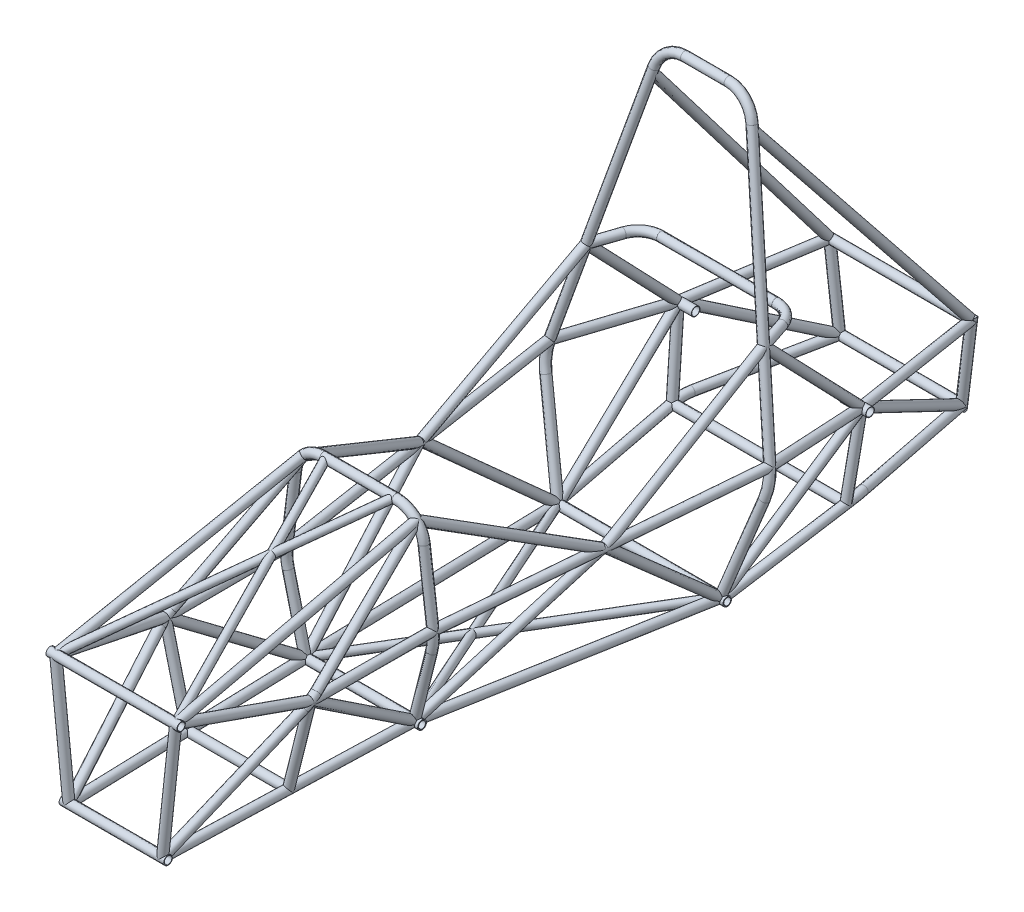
SolidWorks part; units mm, degrees
ref_plane "Front Plane" through (0, 0, 0) normal (0, 0, 1) x (1, 0, 0)
ref_plane "Top Plane" through (0, 0, 0) normal (0, 1, 0) x (1, 0, 0)
ref_plane "Right Plane" through (0, 0, 0) normal (1, 0, 0) x (0, 0, -1)
sketch "Sketch1-sidelayout" plane through (0, 0, 0) normal (1, 0, 0) x (0, 0, -1)
  line L0 (-9.8366, 0) -> (711.2, 0) construction
  line L1 (711.2, 0) -> (1524, -57.15) construction
  line L2 (2286, 19.05) -> (2286, 247.65) construction
  line L3 (1524, -57.15) -> (1905, 19.05) construction
  line L4 (1905, 19.05) -> (2286, 19.05) construction
  line L5 (0, 0) -> (0, 355.6) construction
  line L6 (711.2, 0) -> (711.2, 533.4) construction
  line L7 (1524, -57.15) -> (1721.063, 1060.45) construction
  line L8 (711.2, 533.4) -> (1721.063, 1060.45) construction
  line L9 (1499.739, 381.1358) -> (1499.739, 661.1358) construction
  line L10 (1106.8366, 88.3429) -> (1499.739, 381.1358) construction
  line L11 (711.2, 533.4) -> (0, 355.6) construction
  line L12 (1524, -57.15) -> (1320.235, -57.15) construction
  line L13 (1106.8366, 88.3429) -> (711.4197, 261.8271) construction
  line L14 (2286, 247.65) -> (1707.831, 985.4076) construction
  line L15 (711.4197, 261.8271) -> (233.2798, 25.4) construction
  line L16 (233.2798, 25.4) -> (67.8276, 250.5442) construction
  line L17 (1367.8738, 818.8173) -> (1439.1642, 856.0239) construction
  line L18 (1036.8918, -6.986) -> (1174.6305, -16.6708) construction
  line L19 (2286, 247.65) -> (1905, 247.65) construction
  line L20 (1905, 19.05) -> (1905, 247.65) construction
  line L21 (1905, 247.65) -> (1584.4625, 285.75) construction
  line L22 (355.6, 444.5) -> (355.6, 0) construction
  line L23 (0, 0) -> (711.2, 508) construction
  line L24 (2410.1225, -107.95) -> (-155.516, -107.95) construction
  circle A0 centre (1499.739, 661.1358) radius 150 construction
  circle A1 centre (1499.739, 381.1358) radius 100 construction
  circle A2 centre (1106.8366, 88.3429) radius 100 construction
  circle A3 centre (1499.739, 661.1358) radius 200.8 construction
  point P27 (1577.7445, 247.65)
  point P30 (711.2, 228.6)
  point P31 (711.2, 508)
  point P34 (355.6, 254)
  point P35 (711.2, 254)
  point P39 (-155.516, -107.95)
  point P40 (2410.1225, -107.95)
  dimension "D7" = 300
  dimension "D8" = 200
  dimension "D11" = 200
  dimension "D12" = 50.8
  dimension "D1" = 711.2
  dimension "D2" = 533.4
  dimension "D3" = 355.6
  dimension "D4" = 1524
  dimension "D5" = 57.15
  dimension "D6" = 76.2
  dimension "D9" = 280
  dimension "D10" = 490
  dimension "D13" = 1905
  dimension "D14" = 2286
  dimension "D15" = 228.6
  dimension "D16" = 1117.6
  dimension "D17" = 100
  dimension "D18" = 431.8
  dimension "D19" = 533.4
  dimension "D20" = 279.4
  dimension "D21" = 76.2
  dimension "D22" = 50.8
  dimension "D23" = 15.875
  dimension "D24" = 130
  dimension "D25" = 25.4
  dimension "D26" = 100
  dimension "D27" = 342.9
  dimension "D28" = 304.8
  dimension "D29" = 254
  dimension "D30" = 355.6
  dimension "D31" = 228.6
  dimension "D32" = 254
  dimension "D33" = 50.8
sketch3d "3DSketch1-widths"
  line L0 (-152.4, 0, 0) -> (152.4, 0, 0) construction
  line L1 (-190.5, 355.6, 0) -> (190.5, 355.6, 0) construction
  line L2 (177.8, 533.4, -711.2) -> (-177.8, 533.4, -711.2) construction
  line L3 (180.975, 0, -711.2) -> (-180.975, 0, -711.2) construction
  line L4 (257.175, -57.15, -1524) -> (-257.175, -57.15, -1524) construction
  line L5 (330.2, 247.65, -1577.7445) -> (-330.2, 247.65, -1577.7445) construction
  line L6 (215.9, 228.6, -711.2) -> (-215.9, 228.6, -711.2) construction
  line L7 (254, 19.05, -1905) -> (-254, 19.05, -1905) construction
  line L8 (177.8, 19.05, -2286) -> (-177.8, 19.05, -2286) construction
  line L9 (206.375, 247.65, -2286) -> (-206.375, 247.65, -2286) construction
  dimension "D1" = 304.8
  dimension "D2" = 381
  dimension "D3" = 514.35
  dimension "D4" = 361.95
  dimension "D5" = 660.4
  dimension "D6" = 431.8
  dimension "D10" = 355.6
  dimension "D7" = 508
  dimension "D8" = 355.6
  dimension "D9" = 412.75
sketch3d "3DSketch1-main stations"
  line L0 (-136.525, 0, 0) -> (-174.625, 355.6, 0) construction
  line L1 (-152.4, 0, 0) -> (152.4, 0, 0) construction
  line L2 (-190.5, 355.6, 0) -> (190.5, 355.6, 0) construction
  line L3 (136.525, 0, 0) -> (174.625, 355.6, 0) construction
  line L4 (-212.4397, 256.2828, -711.2) -> (-186.7777, 461.5786, -711.2) construction
  line L5 (-236.5248, -57.15, -1524) -> (-318.357, 209.1154, -1570.9498) construction
  line L6 (236.5248, -57.15, -1524) -> (318.357, 209.1154, -1570.9498) construction
  line L7 (-105.4196, 533.4, -711.2) -> (105.4196, 533.4, -711.2) construction
  line L8 (186.7777, 461.5786, -711.2) -> (212.4397, 256.2828, -711.2) construction
  line L9 (-158.75, 0, -711.2) -> (-209.1337, 201.5348, -711.2) construction
  line L10 (180.975, 0, -711.2) -> (-180.975, 0, -711.2) construction
  line L11 (209.1337, 201.5348, -711.2) -> (158.75, 0, -711.2) construction
  line L12 (63.5, 1060.45, -1721.063) -> (-63.5, 1060.45, -1721.063) construction
  line L13 (320.4636, 286.7525, -1584.6393) -> (143.132, 998.9347, -1710.2162) construction
  line L14 (-143.132, 998.9347, -1710.2162) -> (-320.4636, 286.7525, -1584.6393) construction
  line L15 (257.175, -57.15, -1524) -> (-257.175, -57.15, -1524) construction
  line L16 (320.7132, 285.75, -1584.4625) -> (-320.7132, 285.75, -1584.4625) construction
  line L17 (206.375, 247.65, -2286) -> (177.8, 19.05, -2286) construction
  line L18 (-177.8, 19.05, -2286) -> (-206.375, 247.65, -2286) construction
  line L20 (146.5002, 985.4076, -1707.831) -> (-146.5002, 985.4076, -1707.831) construction
  line L21 (164.7492, 508, -711.2) -> (-164.7492, 508, -711.2) construction
  line L22 (212.725, 254, -711.2) -> (-212.725, 254, -711.2) construction
  arc A0 (105.4196, 533.4, -711.2) -> (186.7777, 461.5786, -711.2) centre (105.4196, 451.4088, -711.2) ccw construction
  arc A1 (-186.7777, 461.5786, -711.2) -> (-105.4196, 533.4, -711.2) centre (-105.4196, 451.4088, -711.2) ccw construction
  arc A2 (-212.4397, 256.2828, -711.2) -> (-209.1337, 201.5348, -711.2) centre (-64.241, 237.7579, -711.2) ccw construction
  arc A3 (212.4397, 256.2828, -711.2) -> (209.1337, 201.5348, -711.2) centre (64.241, 237.7579, -711.2) ccw construction
  arc A4 (63.5, 1060.45, -1721.063) -> (143.132, 998.9347, -1710.2162) centre (63.5, 979.7044, -1706.8254) ccw construction
  arc A5 (-63.5, 1060.45, -1721.063) -> (-143.132, 998.9347, -1710.2162) centre (-63.5, 979.7044, -1706.8254) ccw construction
  arc A6 (318.357, 209.1154, -1570.9498) -> (320.4636, 286.7525, -1584.6393) centre (175.409, 251.7233, -1578.4627) ccw construction
  arc A7 (-318.357, 209.1154, -1570.9498) -> (-320.4636, 286.7525, -1584.6393) centre (-175.409, 251.7233, -1578.4627) ccw construction
  point P26 (177.8, 533.4, -711.2)
  point P27 (105.4196, 451.4088, -793.1912)
  point P30 (-177.8, 533.4, -711.2)
  point P31 (-105.4196, 451.4088, -793.1912)
  point P40 (-215.9, 228.6, -711.2)
  point P41 (-64.241, 237.7579, -561.848)
  point P44 (215.9, 228.6, -711.2)
  point P45 (64.241, 237.7579, -860.552)
  point P59 (127.8148, 1060.45, -1721.063)
  point P60 (63.5, 965.4668, -1787.571)
  point P63 (-127.8148, 1060.45, -1721.063)
  point P64 (-63.5, 993.9421, -1626.0798)
  point P67 (330.2, 247.65, -1577.7445)
  point P68 (175.409, 277.6581, -1431.3797)
  point P71 (-330.2, 247.65, -1577.7445)
  point P72 (-175.409, 225.7886, -1725.5457)
  dimension "D7" = 81.9912
  dimension "D8" = 20.6502
  dimension "D9" = 20.6502
  dimension "D10" = 81.9912
  dimension "D12" = 149.352
  dimension "D13" = 149.352
  dimension "D1" = 15.875
  dimension "D2" = 15.875
  dimension "D3" = 15.875
  dimension "D4" = 15.875
  dimension "D5" = 22.225
  dimension "D6" = 22.225
  dimension "D11" = 127
sketch3d "3DSketch2-sides"
  line L0 (136.525, 0, 0) -> (158.75, 0, -711.2) construction
  line L1 (-152.4, 0, 0) -> (152.4, 0, 0) construction
  line L2 (180.975, 0, -711.2) -> (-180.975, 0, -711.2) construction
  line L3 (-136.525, 0, 0) -> (-158.75, 0, -711.2) construction
  line L4 (158.75, 0, -711.2) -> (236.5248, -57.15, -1524) construction
  line L5 (-236.5248, -57.15, -1524) -> (-158.75, 0, -711.2) construction
  line L6 (241.3, -57.15, -1524) -> (253.2566, 14.5893, -1882.6966) construction
  line L7 (257.175, -57.15, -1524) -> (-257.175, -57.15, -1524) construction
  line L8 (249.5369, 19.05, -1927.3153) -> (177.8, 19.05, -2286) construction
  line L9 (177.8, 19.05, -2286) -> (-177.8, 19.05, -2286) construction
  line L10 (-177.8, 19.05, -2286) -> (-249.5369, 19.05, -1927.3153) construction
  line L11 (-253.2566, 14.5893, -1882.6966) -> (-241.3, -57.15, -1524) construction
  line L12 (292.1, 247.65, -1905) -> (-292.1, 247.65, -1905) construction
  line L13 (320.7132, 285.75, -1584.4625) -> (266.7, 247.65, -1905) construction
  line L14 (-320.7132, 285.75, -1584.4625) -> (-266.7, 247.65, -1905) construction
  line L15 (266.7, 247.65, -1905) -> (206.375, 247.65, -2286) construction
  line L16 (-206.375, 247.65, -2286) -> (-266.7, 247.65, -1905) construction
  line L17 (174.625, 355.6, 0) -> (164.7492, 508, -711.2) construction
  line L18 (-252.9622, 12.8233, -1873.8666) -> (252.9622, 12.8233, -1873.8666) construction
  line L19 (0, 12.8233, -1873.8666) -> (0, 247.65, -1905) construction
  line L20 (0, -57.15, -1524) -> (0, 19.05, -1905) construction
  line L23 (320.7132, 285.75, -1584.4625) -> (212.725, 254, -711.2) construction
  line L24 (-320.7132, 285.75, -1584.4625) -> (-212.725, 254, -711.2) construction
  line L25 (-174.625, 355.6, 0) -> (-164.7492, 508, -711.2) construction
  line L26 (206.375, 247.65, -2286) -> (146.5002, 985.4076, -1707.831) construction
  line L27 (-146.5002, 985.4076, -1707.831) -> (-206.375, 247.65, -2286) construction
  arc A0 (253.2566, 14.5893, -1882.6966) -> (249.5369, 19.05, -1927.3153) centre (139.2726, -79.2428, -1905.2625) ccw construction
  arc A1 (-249.5369, 19.05, -1927.3153) -> (-253.2566, 14.5893, -1882.6966) centre (-139.2726, -79.2428, -1905.2625) ccw construction
  point P28 (254, 19.05, -1905)
  point P29 (42.8886, 33.2052, -1885.9857)
  point P38 (-254, 19.05, -1905)
  point P39 (-42.8886, 33.2052, -1885.9857)
  point P52 (215.9, 247.65, -1905)
  point P54 (-215.9, 247.65, -1905)
  point P62 (0, 12.8233, -1873.8666)
  dimension "D3" = 149.352
  dimension "D6" = 149.352
  dimension "D2" = 15.875
  dimension "D4" = 15.875
  dimension "D5" = 31.75
  dimension "D7" = 76.2
  dimension "D8" = 25.4
  dimension "D9" = 76.2
  dimension "D10" = 25.4
  dimension "D11" = 431.8
sketch3d "3DSketch3-side diag"
  line L0 (212.725, 254, -355.6) -> (-212.725, 254, -355.6) construction
  line L1 (174.625, 355.6, 0) -> (211.2274, 254, -355.6) construction
  line L2 (136.525, 0, 0) -> (209.0836, 241.8621, -338.6069) construction
  line L3 (210.4117, 266.2475, -372.7465) -> (164.7492, 508, -711.2) construction
  line L4 (164.7492, 508, -711.2) -> (266.8518, 269.914, -1148.904) construction
  line L5 (-174.625, 355.6, 0) -> (-211.2274, 254, -355.6) construction
  line L6 (-164.7492, 508, -711.2) -> (-266.8518, 269.914, -1148.904) construction
  line L7 (-158.75, 0, -711.2) -> (-211.2274, 254, -355.6) construction
  line L8 (320.7132, 285.75, -1584.4625) -> (212.725, 254, -711.2) construction
  line L9 (-320.7132, 285.75, -1584.4625) -> (-212.725, 254, -711.2) construction
  line L10 (267.7546, 270.1795, -1156.2054) -> (258.4287, 535.8912, -1628.5692) construction
  line L11 (320.4636, 286.7525, -1584.6393) -> (143.132, 998.9347, -1710.2162) construction
  line L12 (-267.7546, 270.1795, -1156.2054) -> (-258.4287, 535.8912, -1628.5692) construction
  line L13 (-143.132, 998.9347, -1710.2162) -> (-320.4636, 286.7525, -1584.6393) construction
  line L14 (-258.4287, 535.8912, -1628.5692) -> (258.4287, 535.8912, -1628.5692) construction
  line L15 (0, -57.15, -1524) -> (0, 1060.45, -1721.063) construction
  line L16 (258.4287, 535.8912, -1628.5692) -> (266.7, 247.65, -1905) construction
  line L17 (-266.7, 247.65, -1905) -> (-258.4287, 535.8912, -1628.5692) construction
  line L18 (158.75, 0, -711.2) -> (266.8518, 269.914, -1148.904) construction
  line L19 (-158.75, 0, -711.2) -> (-266.8518, 269.914, -1148.904) construction
  line L20 (-267.7546, 270.1795, -1156.2054) -> (-236.5248, -57.15, -1524) construction
  line L21 (267.7546, 270.1795, -1156.2054) -> (236.5248, -57.15, -1524) construction
  line L22 (236.5248, -57.15, -1524) -> (266.7, 247.65, -1905) construction
  line L23 (266.7, 247.65, -1905) -> (177.8, 19.05, -2286) construction
  line L24 (-177.8, 19.05, -2286) -> (-266.7, 247.65, -1905) construction
  line L25 (-266.7, 247.65, -1905) -> (-236.5248, -57.15, -1524) construction
  line L26 (-136.525, 0, 0) -> (-209.0836, 241.8621, -338.6069) construction
  line L27 (-210.4117, 266.2475, -372.7465) -> (-164.7492, 508, -711.2) construction
  line L28 (158.75, 0, -711.2) -> (211.2274, 254, -355.6) construction
  line L29 (147.6375, 0, -355.6) -> (-147.6375, 0, -355.6) construction
  line L30 (136.525, 0, 0) -> (158.75, 0, -711.2) construction
  line L31 (147.6375, 0, -355.6) -> (211.2274, 254, -355.6) construction
  line L32 (-147.6375, 0, -355.6) -> (-211.2274, 254, -355.6) construction
  line L33 (-136.525, 0, 0) -> (-158.75, 0, -711.2) construction
  line L34 (212.725, 254, -711.2) -> (211.2274, 254, -355.6) construction
  line L35 (-211.2274, 254, -355.6) -> (-212.725, 254, -711.2) construction
  line L36 (-152.4, 0, 0) -> (152.4, 0, 0) construction
  line L37 (252.9622, 12.8233, -1873.8666) -> (266.7, 247.65, -1905) construction
  line L38 (-266.7, 247.65, -1905) -> (-252.9622, 12.8233, -1873.8666) construction
  line L39 (0, 535.8912, -1628.5692) -> (0, 535.8912, -1755.5692) construction
  line L40 (215.9, 535.8912, -1755.5692) -> (-215.9, 535.8912, -1755.5692) construction
  line L41 (215.9, 535.8912, -1755.5692) -> (258.4287, 535.8912, -1628.5692) construction
  line L42 (-215.9, 535.8912, -1755.5692) -> (-258.4287, 535.8912, -1628.5692) construction
  arc A0 (210.4117, 266.2475, -372.7465) -> (209.0836, 241.8621, -338.6069) centre (61.9517, 256.7741, -359.4837) ccw construction
  arc A1 (-210.4117, 266.2475, -372.7465) -> (-209.0836, 241.8621, -338.6069) centre (-61.9517, 256.7741, -359.4837) ccw construction
  point P5 (212.725, 254, -355.6)
  point P8 (61.9517, 135.2414, -446.2928)
  point P11 (-212.725, 254, -355.6)
  point P30 (0, 535.8912, -1628.5692)
  point P55 (-61.9517, 378.3068, -272.6746)
  dimension "D7" = 149.352
  dimension "D8" = 149.352
  dimension "D1" = 441.325
  dimension "D6" = 425.45
  dimension "D2" = 441.325
  dimension "D3" = 254
  dimension "D4" = 431.8
  dimension "D5" = 431.8
  dimension "D9" = 127
  dimension "D10" = 431.8
sketch3d "3DSketch4-cross sup"
  line L0 (158.75, 0, -711.2) -> (-236.5248, -57.15, -1524) construction
  line L1 (236.5248, -57.15, -1524) -> (-158.75, 0, -711.2) construction
  line L2 (0, 0, -711.2) -> (0, -57.15, -1524) construction
  line L7 (174.625, 355.6, 0) -> (-99.0696, 533.4, -711.2) construction
  line L8 (99.0696, 533.4, -711.2) -> (-174.625, 355.6, 0) construction
  line L9 (177.8, 533.4, -711.2) -> (-177.8, 533.4, -711.2) construction
  point P8 (0, -22.9525, -1037.6362)
  point P32 (0, 469.0415, -453.7659)
  dimension "D3" = 6.35
sketch3d "3DSketch5"
  line L0 (-152.4, 0, 0) -> (152.4, 0, 0)
  line L1 (-152.4, 0, 0) -> (152.4, 0, 0) construction
  line L2 (-190.5, 355.6, 0) -> (190.5, 355.6, 0)
  line L3 (-190.5, 355.6, 0) -> (190.5, 355.6, 0) construction
  line L4 (136.525, 0, 0) -> (174.625, 355.6, 0)
  line L5 (136.525, 0, 0) -> (174.625, 355.6, 0) construction
  line L6 (-136.525, 0, 0) -> (-174.625, 355.6, 0)
  line L7 (-136.525, 0, 0) -> (-174.625, 355.6, 0) construction
  line L8 (-136.525, 0, 0) -> (-158.75, 0, -711.2) construction
  line L9 (-180.975, 0, -711.2) -> (180.975, 0, -711.2)
  line L10 (180.975, 0, -711.2) -> (-180.975, 0, -711.2) construction
  line L11 (-158.75, 0, -711.2) -> (-209.1337, 201.5348, -711.2)
  line L12 (-158.75, 0, -711.2) -> (-209.1337, 201.5348, -711.2) construction
  line L13 (-212.4397, 256.2828, -711.2) -> (-186.7777, 461.5786, -711.2)
  line L14 (-105.4196, 533.4, -711.2) -> (105.4196, 533.4, -711.2)
  line L15 (186.7777, 461.5786, -711.2) -> (212.4397, 256.2828, -711.2)
  line L16 (177.8, 533.4, -711.2) -> (-177.8, 533.4, -711.2) construction
  line L17 (-212.4397, 256.2828, -711.2) -> (-186.7777, 461.5786, -711.2) construction
  line L18 (186.7777, 461.5786, -711.2) -> (212.4397, 256.2828, -711.2) construction
  line L19 (209.1337, 201.5348, -711.2) -> (158.75, 0, -711.2)
  line L20 (209.1337, 201.5348, -711.2) -> (158.75, 0, -711.2) construction
  line L21 (-236.5248, -57.15, -1524) -> (-318.357, 209.1154, -1570.9498)
  line L22 (-320.4636, 286.7525, -1584.6393) -> (-143.132, 998.9347, -1710.2162)
  line L23 (-63.5, 1060.45, -1721.063) -> (63.5, 1060.45, -1721.063)
  line L24 (143.132, 998.9347, -1710.2162) -> (320.4636, 286.7525, -1584.6393)
  line L25 (318.357, 209.1154, -1570.9498) -> (236.5248, -57.15, -1524)
  line L26 (236.5248, -57.15, -1524) -> (318.357, 209.1154, -1570.9498) construction
  line L27 (320.4636, 286.7525, -1584.6393) -> (143.132, 998.9347, -1710.2162) construction
  line L28 (63.5, 1060.45, -1721.063) -> (-63.5, 1060.45, -1721.063) construction
  line L29 (-143.132, 998.9347, -1710.2162) -> (-320.4636, 286.7525, -1584.6393) construction
  line L30 (-236.5248, -57.15, -1524) -> (-318.357, 209.1154, -1570.9498) construction
  line L31 (257.175, -57.15, -1524) -> (-257.175, -57.15, -1524) construction
  line L32 (-257.175, -57.15, -1524) -> (257.175, -57.15, -1524)
  line L33 (-206.375, 247.65, -2286) -> (206.375, 247.65, -2286)
  line L34 (206.375, 247.65, -2286) -> (177.8, 19.05, -2286)
  line L35 (177.8, 19.05, -2286) -> (-177.8, 19.05, -2286)
  line L36 (-177.8, 19.05, -2286) -> (-206.375, 247.65, -2286)
  line L37 (-177.8, 19.05, -2286) -> (-206.375, 247.65, -2286) construction
  line L38 (206.375, 247.65, -2286) -> (-206.375, 247.65, -2286) construction
  line L39 (177.8, 19.05, -2286) -> (-177.8, 19.05, -2286) construction
  line L40 (206.375, 247.65, -2286) -> (177.8, 19.05, -2286) construction
  line L41 (-292.1, 247.65, -1905) -> (-215.9, 247.65, -1905)
  line L43 (292.1, 247.65, -1905) -> (-292.1, 247.65, -1905) construction
  line L44 (215.9, 247.65, -1905) -> (292.1, 247.65, -1905)
  arc A0 (-186.7777, 461.5786, -711.2) -> (-105.4196, 533.4, -711.2) centre (-105.4196, 451.4088, -711.2) ccw
  arc A1 (105.4196, 533.4, -711.2) -> (186.7777, 461.5786, -711.2) centre (105.4196, 451.4088, -711.2) ccw
  arc A2 (-209.1337, 201.5348, -711.2) -> (-212.4397, 256.2828, -711.2) centre (-64.241, 237.7579, -711.2) ccw
  arc A3 (212.4397, 256.2828, -711.2) -> (209.1337, 201.5348, -711.2) centre (64.241, 237.7579, -711.2) ccw
  arc A4 (212.4397, 256.2828, -711.2) -> (209.1337, 201.5348, -711.2) centre (64.241, 237.7579, -711.2) ccw construction
  arc A5 (-212.4397, 256.2828, -711.2) -> (-209.1337, 201.5348, -711.2) centre (-64.241, 237.7579, -711.2) ccw construction
  arc A6 (105.4196, 533.4, -711.2) -> (186.7777, 461.5786, -711.2) centre (105.4196, 451.4088, -711.2) ccw construction
  arc A7 (-186.7777, 461.5786, -711.2) -> (-105.4196, 533.4, -711.2) centre (-105.4196, 451.4088, -711.2) ccw construction
  arc A8 (63.5, 1060.45, -1721.063) -> (143.132, 998.9347, -1710.2162) centre (63.5, 979.7044, -1706.8254) ccw
  arc A9 (-143.132, 998.9347, -1710.2162) -> (-63.5, 1060.45, -1721.063) centre (-63.5, 979.7044, -1706.8254) ccw
  arc A10 (-318.357, 209.1154, -1570.9498) -> (-320.4636, 286.7525, -1584.6393) centre (-175.409, 251.7233, -1578.4627) ccw
  arc A11 (320.4636, 286.7525, -1584.6393) -> (318.357, 209.1154, -1570.9498) centre (175.409, 251.7233, -1578.4627) ccw
  arc A12 (-63.5, 1060.45, -1721.063) -> (-143.132, 998.9347, -1710.2162) centre (-63.5, 979.7044, -1706.8254) ccw construction
  arc A13 (63.5, 1060.45, -1721.063) -> (143.132, 998.9347, -1710.2162) centre (63.5, 979.7044, -1706.8254) ccw construction
  arc A14 (-318.357, 209.1154, -1570.9498) -> (-320.4636, 286.7525, -1584.6393) centre (-175.409, 251.7233, -1578.4627) ccw construction
  arc A15 (318.357, 209.1154, -1570.9498) -> (320.4636, 286.7525, -1584.6393) centre (175.409, 251.7233, -1578.4627) ccw construction
  point P47 (-105.4196, 451.4088, -793.1912)
  point P51 (105.4196, 451.4088, -793.1912)
  point P55 (-64.241, 237.7579, -860.552)
  point P58 (64.241, 237.7579, -860.552)
  point P59 (64.241, 237.7579, -860.552)
  point P63 (-64.241, 237.7579, -561.848)
  point P67 (105.4196, 451.4088, -793.1912)
  point P71 (-105.4196, 451.4088, -793.1912)
  point P120 (63.5, 965.4668, -1787.571)
  point P124 (-63.5, 965.4668, -1787.571)
  point P128 (-175.409, 225.7886, -1725.5457)
  point P132 (175.409, 225.7886, -1725.5457)
  point P134 (-63.5, 993.9421, -1626.0798)
  point P138 (63.5, 965.4668, -1787.571)
  point P140 (-175.409, 225.7886, -1725.5457)
  point P144 (175.409, 277.6581, -1431.3797)
other "Structural Member1"
ref_plane "Plane1" through (-190.5, 355.6, 0) normal (1, 0, 0) x (0, 0, -1)
sketch "Sketch18" plane through (-190.5, 355.6, 0) normal (1, 0, 0) x (0, 0, -1)
  circle A0 centre (0, 0) radius 12.7
  circle A1 centre (0, 0) radius 11.049
  point P4 (0, 0)
  dimension "D1" = 25.4
  dimension "D2" = 1.651
other "Structural Member2"
ref_plane "Plane2" through (-152.4, 0, 0) normal (1, 0, 0) x (0, 0, -1)
sketch "Sketch1" plane through (-152.4, 0, 0) normal (1, 0, 0) x (0, 0, -1)
  circle A0 centre (0, 0) radius 12.7
  circle A1 centre (0, 0) radius 11.049
  point P4 (0, 0)
  dimension "D1" = 25.4
  dimension "D2" = 1.651
other "Structural Member3"
ref_plane "Plane3" through (136.525, 0, 0) normal (0.1065, 0.9943, 0) x (0.9887, -0.1059, -0.1065)
sketch "Sketch19" plane through (136.525, 0, 0) normal (0.1065, 0.9943, 0) x (0.9887, -0.1059, -0.1065)
  circle A0 centre (0, 0) radius 12.7
  circle A1 centre (0, 0) radius 11.049
  point P4 (0, 0)
  dimension "D1" = 25.4
  dimension "D2" = 1.651
other "Trim/Extend1"
other "Structural Member4"
ref_plane "Plane4" through (-136.525, 0, 0) normal (-0.1065, 0.9943, 0) x (0.9887, 0.1059, 0.1065)
sketch "Sketch110" plane through (-136.525, 0, 0) normal (-0.1065, 0.9943, 0) x (0.9887, 0.1059, 0.1065)
  circle A0 centre (0, 0) radius 12.7
  circle A1 centre (0, 0) radius 11.049
  point P4 (0, 0)
  dimension "D1" = 25.4
  dimension "D2" = 1.651
other "Trim/Extend2"
other "Structural Member5"
ref_plane "Plane5" through (-158.75, 0, -711.2) normal (-0.2425, 0.9701, 0) x (0.9412, 0.2353, 0.2425)
sketch "Sketch14" plane through (-158.75, 0, -711.2) normal (-0.2425, 0.9701, 0) x (0.9412, 0.2353, 0.2425)
  circle A0 centre (0, 0) radius 12.7
  circle A1 centre (0, 0) radius 10.287
  point P4 (0, 0)
  dimension "D1" = 25.4
  dimension "D2" = 2.413
other "Structural Member6"
ref_plane "Plane6" through (-180.975, 0, -711.2) normal (1, 0, 0) x (0, 0, -1)
sketch "Sketch15" plane through (-180.975, 0, -711.2) normal (1, 0, 0) x (0, 0, -1)
  circle A0 centre (0, 0) radius 12.7
  circle A1 centre (0, 0) radius 10.287
  point P4 (0, 0)
  dimension "D1" = 25.4
  dimension "D2" = 2.413
other "Trim/Extend3"
other "Structural Member7"
ref_plane "Plane7" through (-257.175, -57.15, -1524) normal (1, 0, 0) x (0, 0, -1)
sketch "Sketch16" plane through (-257.175, -57.15, -1524) normal (1, 0, 0) x (0, 0, -1)
  circle A0 centre (0, 0) radius 12.7
  circle A1 centre (0, 0) radius 10.287
  point P4 (0, 0)
  dimension "D1" = 25.4
  dimension "D2" = 2.413
other "Structural Member8"
ref_plane "Plane8" through (-236.5248, -57.15, -1524) normal (-0.2897, 0.9426, -0.1662) x (0.8994, 0.3275, 0.2897)
sketch "Sketch17" plane through (-236.5248, -57.15, -1524) normal (-0.2897, 0.9426, -0.1662) x (0.8994, 0.3275, 0.2897)
  circle A0 centre (0, 0) radius 12.7
  circle A1 centre (0, 0) radius 10.287
  point P4 (0, 0)
  dimension "D1" = 25.4
  dimension "D2" = 2.413
other "Trim/Extend4"
other "Structural Member9"
ref_plane "Plane9" through (-206.375, 247.65, -2286) normal (1, 0, 0) x (0, 0, -1)
sketch "Sketch111" plane through (-206.375, 247.65, -2286) normal (1, 0, 0) x (0, 0, -1)
  circle A0 centre (0, 0) radius 12.7
  circle A1 centre (0, 0) radius 11.4554
  point P4 (0, 0)
  dimension "D1" = 25.4
  dimension "D2" = 1.2446
other "Structural Member10"
ref_plane "Plane10" through (177.8, 19.05, -2286) normal (-1, 0, 0) x (0, 0, 1)
sketch "Sketch112" plane through (177.8, 19.05, -2286) normal (-1, 0, 0) x (0, 0, 1)
  circle A0 centre (0, 0) radius 12.7
  circle A1 centre (0, 0) radius 11.4554
  point P4 (0, 0)
  dimension "D1" = 25.4
  dimension "D2" = 1.2446
other "Structural Member11"
ref_plane "Plane11" through (206.375, 247.65, -2286) normal (-0.124, -0.9923, 0) x (0.9846, -0.1231, 0.124)
sketch "Sketch113" plane through (206.375, 247.65, -2286) normal (-0.124, -0.9923, 0) x (0.9846, -0.1231, 0.124)
  circle A0 centre (0, 0) radius 12.7
  circle A1 centre (0, 0) radius 11.4554
  point P4 (0, 0)
  dimension "D1" = 25.4
  dimension "D2" = 1.2446
other "Trim/Extend5"
other "Trim/Extend6"
other "Structural Member12"
ref_plane "Plane12" through (-177.8, 19.05, -2286) normal (-0.124, 0.9923, 0) x (0.9846, 0.1231, 0.124)
sketch "Sketch114" plane through (-177.8, 19.05, -2286) normal (-0.124, 0.9923, 0) x (0.9846, 0.1231, 0.124)
  circle A0 centre (0, 0) radius 12.7
  circle A1 centre (0, 0) radius 11.4554
  point P4 (0, 0)
  dimension "D1" = 25.4
  dimension "D2" = 1.2446
other "Trim/Extend7"
other "Trim/Extend8"
other "Structural Member13"
ref_plane "Plane13"
sketch "Sketch115" plane through (215.9, 247.65, -1905) normal (1, 0, 0) x (0, 0, -1)
  circle A0 centre (0, 0) radius 12.7
  circle A1 centre (0, 0) radius 11.4554
  point P4 (0, 0)
  dimension "D1" = 25.4
  dimension "D2" = 1.2446
sketch3d "3DSketch6"
  line L0 (241.3, -57.15, -1524) -> (253.2566, 14.5893, -1882.6966)
  line L1 (249.5369, 19.05, -1927.3153) -> (177.8, 19.05, -2286)
  line L2 (241.3, -57.15, -1524) -> (253.2566, 14.5893, -1882.6966) construction
  line L3 (249.5369, 19.05, -1927.3153) -> (177.8, 19.05, -2286) construction
  line L4 (177.8, 19.05, -2286) -> (-177.8, 19.05, -2286) construction
  line L5 (257.175, -57.15, -1524) -> (-257.175, -57.15, -1524) construction
  line L6 (-177.8, 19.05, -2286) -> (-249.5369, 19.05, -1927.3153)
  line L7 (-253.2566, 14.5893, -1882.6966) -> (-241.3, -57.15, -1524)
  line L8 (252.9622, 12.8233, -1873.8666) -> (266.7, 247.65, -1905)
  line L9 (-253.2566, 14.5893, -1882.6966) -> (-241.3, -57.15, -1524) construction
  line L10 (-177.8, 19.05, -2286) -> (-249.5369, 19.05, -1927.3153) construction
  line L11 (158.75, 0, -711.2) -> (236.5248, -57.15, -1524)
  line L12 (158.75, 0, -711.2) -> (236.5248, -57.15, -1524) construction
  line L13 (180.975, 0, -711.2) -> (-180.975, 0, -711.2) construction
  line L14 (-158.75, 0, -711.2) -> (-236.5248, -57.15, -1524)
  line L15 (-236.5248, -57.15, -1524) -> (-158.75, 0, -711.2) construction
  line L16 (-147.6375, 0, -355.6) -> (147.6375, 0, -355.6)
  line L17 (-252.9622, 12.8233, -1873.8666) -> (-266.7, 247.65, -1905)
  line L18 (147.6375, 0, -355.6) -> (-147.6375, 0, -355.6) construction
  line L19 (136.525, 0, 0) -> (158.75, 0, -711.2)
  line L20 (-152.4, 0, 0) -> (152.4, 0, 0) construction
  line L21 (136.525, 0, 0) -> (158.75, 0, -711.2) construction
  line L22 (147.6375, 0, -355.6) -> (211.2274, 254, -355.6) construction
  line L23 (-147.6375, 0, -355.6) -> (-211.2274, 254, -355.6)
  line L24 (209.1337, 201.5348, -711.2) -> (158.75, 0, -711.2) construction
  line L25 (-136.525, 0, 0) -> (-158.75, 0, -711.2)
  line L26 (-136.525, 0, 0) -> (-158.75, 0, -711.2) construction
  line L27 (-147.6375, 0, -355.6) -> (-211.2274, 254, -355.6) construction
  line L28 (-266.7, 247.65, -1905) -> (-252.9622, 12.8233, -1873.8666) construction
  line L29 (174.625, 355.6, 0) -> (164.7492, 508, -711.2)
  line L30 (174.625, 355.6, 0) -> (164.7492, 508, -711.2) construction
  line L31 (-190.5, 355.6, 0) -> (190.5, 355.6, 0) construction
  line L32 (-174.625, 355.6, 0) -> (-164.7492, 508, -711.2)
  line L33 (-174.625, 355.6, 0) -> (-164.7492, 508, -711.2) construction
  line L34 (136.525, 0, 0) -> (209.0836, 241.8621, -338.6069)
  line L35 (210.4117, 266.2475, -372.7465) -> (164.7492, 508, -711.2)
  line L36 (210.4117, 266.2475, -372.7465) -> (164.7492, 508, -711.2) construction
  line L37 (252.9622, 12.8233, -1873.8666) -> (266.7, 247.65, -1905) construction
  line L38 (164.7492, 508, -711.2) -> (-164.7492, 508, -711.2) construction
  line L39 (-136.525, 0, 0) -> (-209.0836, 241.8621, -338.6069)
  line L40 (-210.4117, 266.2475, -372.7465) -> (-164.7492, 508, -711.2)
  line L41 (-136.525, 0, 0) -> (-209.0836, 241.8621, -338.6069) construction
  line L42 (-210.4117, 266.2475, -372.7465) -> (-164.7492, 508, -711.2) construction
  line L43 (212.725, 254, -711.2) -> (320.7132, 285.75, -1584.4625)
  line L44 (320.7132, 285.75, -1584.4625) -> (212.725, 254, -711.2) construction
  line L45 (186.7777, 461.5786, -711.2) -> (212.4397, 256.2828, -711.2) construction
  line L46 (320.4636, 286.7525, -1584.6393) -> (143.132, 998.9347, -1710.2162) construction
  line L47 (-320.7132, 285.75, -1584.4625) -> (-212.725, 254, -711.2)
  line L48 (-320.7132, 285.75, -1584.4625) -> (-212.725, 254, -711.2) construction
  line L49 (-143.132, 998.9347, -1710.2162) -> (-320.4636, 286.7525, -1584.6393) construction
  line L50 (-212.4397, 256.2828, -711.2) -> (-186.7777, 461.5786, -711.2) construction
  line L51 (320.7132, 285.75, -1584.4625) -> (266.7, 247.65, -1905)
  line L52 (266.7, 247.65, -1905) -> (206.375, 247.65, -2286)
  line L53 (266.7, 247.65, -1905) -> (206.375, 247.65, -2286) construction
  line L54 (320.7132, 285.75, -1584.4625) -> (266.7, 247.65, -1905) construction
  line L55 (206.375, 247.65, -2286) -> (-206.375, 247.65, -2286) construction
  line L56 (-320.7132, 285.75, -1584.4625) -> (-266.7, 247.65, -1905)
  line L57 (-266.7, 247.65, -1905) -> (-206.375, 247.65, -2286)
  line L58 (-206.375, 247.65, -2286) -> (-266.7, 247.65, -1905) construction
  line L59 (-320.7132, 285.75, -1584.4625) -> (-266.7, 247.65, -1905) construction
  line L60 (211.2274, 254, -355.6) -> (212.725, 254, -711.2)
  line L61 (212.725, 254, -711.2) -> (211.2274, 254, -355.6) construction
  line L62 (-212.725, 254, -711.2) -> (-211.2274, 254, -355.6)
  line L63 (-211.2274, 254, -355.6) -> (-212.725, 254, -711.2) construction
  line L64 (-252.9622, 12.8233, -1873.8666) -> (252.9622, 12.8233, -1873.8666)
  line L65 (-252.9622, 12.8233, -1873.8666) -> (252.9622, 12.8233, -1873.8666) construction
  line L66 (211.2274, 254, -355.6) -> (147.6375, 0, -355.6)
  line L67 (292.1, 247.65, -1905) -> (-292.1, 247.65, -1905) construction
  arc A0 (253.2566, 14.5893, -1882.6966) -> (249.5369, 19.05, -1927.3153) centre (139.2726, -79.2428, -1905.2625) ccw
  arc A1 (253.2566, 14.5893, -1882.6966) -> (249.5369, 19.05, -1927.3153) centre (139.2726, -79.2428, -1905.2625) ccw construction
  arc A2 (-249.5369, 19.05, -1927.3153) -> (-253.2566, 14.5893, -1882.6966) centre (-139.2726, -79.2428, -1905.2625) ccw
  arc A3 (-249.5369, 19.05, -1927.3153) -> (-253.2566, 14.5893, -1882.6966) centre (-139.2726, -79.2428, -1905.2625) ccw construction
  arc A4 (105.4196, 533.4, -711.2) -> (186.7777, 461.5786, -711.2) centre (105.4196, 451.4088, -711.2) ccw construction
  arc A5 (-186.7777, 461.5786, -711.2) -> (-105.4196, 533.4, -711.2) centre (-105.4196, 451.4088, -711.2) ccw construction
  arc A6 (209.0836, 241.8621, -338.6069) -> (210.4117, 266.2475, -372.7465) centre (61.9517, 256.7741, -359.4837) ccw
  arc A7 (210.4117, 266.2475, -372.7465) -> (209.0836, 241.8621, -338.6069) centre (61.9517, 256.7741, -359.4837) ccw construction
  arc A8 (-209.0836, 241.8621, -338.6069) -> (-210.4117, 266.2475, -372.7465) centre (-61.9517, 256.7741, -359.4837) ccw
  arc A9 (-210.4117, 266.2475, -372.7465) -> (-209.0836, 241.8621, -338.6069) centre (-61.9517, 256.7741, -359.4837) ccw construction
  point P14 (42.8886, 33.2052, -1885.9857)
  point P17 (42.8886, 33.2052, -1885.9857)
  point P28 (-42.8886, 33.2052, -1885.9857)
  point P31 (-42.8886, 33.2052, -1885.9857)
  point P73 (105.4196, 451.4088, -793.1912)
  point P81 (-105.4196, 451.4088, -793.1912)
  point P92 (61.9517, 378.3068, -272.6746)
  point P95 (61.9517, 135.2414, -446.2928)
  point P104 (-61.9517, 135.2414, -446.2928)
  point P107 (-61.9517, 378.3068, -272.6746)
other "Structural Member14"
ref_plane "Plane14" through (136.525, 0, 0) normal (0.0312, 0, -0.9995) x (-0.9995, 0, -0.0312)
sketch "Sketch116" plane through (136.525, 0, 0) normal (0.0312, 0, -0.9995) x (-0.9995, 0, -0.0312)
  circle A0 centre (0, 0) radius 12.7
  circle A1 centre (0, 0) radius 11.049
  point P4 (0, 0)
  dimension "D1" = 25.4
  dimension "D2" = 1.651
other "Trim/Extend9"
other "Structural Member15"
ref_plane "Plane15" through (-136.525, 0, 0) normal (-0.0312, 0, -0.9995) x (-0.9995, 0, 0.0312)
sketch "Sketch117" plane through (-136.525, 0, 0) normal (-0.0312, 0, -0.9995) x (-0.9995, 0, 0.0312)
  circle A0 centre (0, 0) radius 12.7
  circle A1 centre (0, 0) radius 11.049
  point P4 (0, 0)
  dimension "D1" = 25.4
  dimension "D2" = 1.651
other "Trim/Extend10"
other "Structural Member16"
ref_plane "Plane16" through (174.625, 355.6, 0) normal (-0.0136, 0.2095, -0.9777) x (0.9917, 0.1276, 0.0136)
sketch "Sketch118" plane through (174.625, 355.6, 0) normal (-0.0136, 0.2095, -0.9777) x (0.9917, 0.1276, 0.0136)
  circle A0 centre (0, 0) radius 12.7
  circle A1 centre (0, 0) radius 11.4554
  point P4 (0, 0)
  dimension "D1" = 25.4
  dimension "D2" = 1.2446
other "Trim/Extend11"
other "Structural Member17"
ref_plane "Plane17" through (-174.625, 355.6, 0) normal (0.0136, 0.2095, -0.9777) x (0.9917, -0.1276, -0.0136)
sketch "Sketch119" plane through (-174.625, 355.6, 0) normal (0.0136, 0.2095, -0.9777) x (0.9917, -0.1276, -0.0136)
  circle A0 centre (0, 0) radius 12.7
  circle A1 centre (0, 0) radius 11.4554
  point P4 (0, 0)
  dimension "D1" = 25.4
  dimension "D2" = 1.2446
other "Trim/Extend12"
other "Structural Member18"
ref_plane "Plane18" through (136.525, 0, 0) normal (0.1718, 0.5726, -0.8016) x (0.8512, -0.4959, -0.1718)
sketch "Sketch120" plane through (136.525, 0, 0) normal (0.1718, 0.5726, -0.8016) x (0.8512, -0.4959, -0.1718)
  circle A0 centre (0, 0) radius 12.7
  circle A1 centre (0, 0) radius 11.4554
  point P4 (0, 0)
  dimension "D1" = 25.4
  dimension "D2" = 1.2446
other "Trim/Extend13"
other "Trim/Extend14"
other "Structural Member19"
ref_plane "Plane19" through (-136.525, 0, 0) normal (-0.1718, 0.5726, -0.8016) x (0.8512, 0.4959, 0.1718)
sketch "Sketch121" plane through (-136.525, 0, 0) normal (-0.1718, 0.5726, -0.8016) x (0.8512, 0.4959, 0.1718)
  circle A0 centre (0, 0) radius 12.7
  circle A1 centre (0, 0) radius 11.4554
  point P4 (0, 0)
  dimension "D1" = 25.4
  dimension "D2" = 1.2446
other "Trim/Extend15"
other "Trim/Extend16"
other "Structural Member20"
ref_plane "Plane20" through (-147.6375, 0, -355.6) normal (1, 0, 0) x (0, 0, -1)
sketch "Sketch122" plane through (-147.6375, 0, -355.6) normal (1, 0, 0) x (0, 0, -1)
  circle A0 centre (0, 0) radius 12.7
  circle A1 centre (0, 0) radius 11.4554
  point P4 (0, 0)
  dimension "D1" = 25.4
  dimension "D2" = 1.2446
other "Trim/Extend17"
other "Structural Member21"
ref_plane "Plane21" through (211.2274, 254, -355.6) normal (-0.2429, -0.9701, 0) x (0.941, -0.2356, 0.2429)
sketch "Sketch123" plane through (211.2274, 254, -355.6) normal (-0.2429, -0.9701, 0) x (0.941, -0.2356, 0.2429)
  circle A0 centre (0, 0) radius 12.7
  circle A1 centre (0, 0) radius 11.4554
  point P4 (0, 0)
  dimension "D1" = 25.4
  dimension "D2" = 1.2446
other "Trim/Extend18"
other "Structural Member22"
ref_plane "Plane22" through (-147.6375, 0, -355.6) normal (-0.2429, 0.9701, 0) x (0.941, 0.2356, 0.2429)
sketch "Sketch124" plane through (-147.6375, 0, -355.6) normal (-0.2429, 0.9701, 0) x (0.941, 0.2356, 0.2429)
  circle A0 centre (0, 0) radius 12.7
  circle A1 centre (0, 0) radius 11.4554
  point P4 (0, 0)
  dimension "D1" = 25.4
  dimension "D2" = 1.2446
other "Trim/Extend19"
other "Structural Member23"
ref_plane "Plane23" through (211.2274, 254, -355.6) normal (0.0042, 0, -1) x (-1, 0, -0.0042)
sketch "Sketch126" plane through (211.2274, 254, -355.6) normal (0.0042, 0, -1) x (-1, 0, -0.0042)
  circle A0 centre (0, 0) radius 12.7
  circle A1 centre (0, 0) radius 11.4554
  point P4 (0, 0)
  dimension "D1" = 25.4
  dimension "D2" = 1.2446
other "Trim/Extend20"
other "Structural Member24"
ref_plane "Plane24" through (-212.725, 254, -711.2) normal (0.0042, 0, 1) x (1, 0, -0.0042)
sketch "Sketch127" plane through (-212.725, 254, -711.2) normal (0.0042, 0, 1) x (1, 0, -0.0042)
  circle A0 centre (0, 0) radius 12.7
  circle A1 centre (0, 0) radius 11.4554
  point P4 (0, 0)
  dimension "D1" = 25.4
  dimension "D2" = 1.2446
other "Trim/Extend21"
other "Structural Member25"
ref_plane "Plane25" through (158.75, 0, -711.2) normal (0.095, -0.0698, -0.993) x (-0.2942, 0.951, -0.095)
sketch "Sketch128" plane through (158.75, 0, -711.2) normal (0.095, -0.0698, -0.993) x (-0.2942, 0.951, -0.095)
  circle A0 centre (0, 0) radius 12.7
  circle A1 centre (0, 0) radius 11.049
  point P4 (0, 0)
  dimension "D1" = 25.4
  dimension "D2" = 1.651
other "Trim/Extend22"
other "Structural Member26"
ref_plane "Plane26" through (-158.75, 0, -711.2) normal (-0.095, -0.0698, -0.993) x (-0.2942, -0.951, 0.095)
sketch "Sketch129" plane through (-158.75, 0, -711.2) normal (-0.095, -0.0698, -0.993) x (-0.2942, -0.951, 0.095)
  circle A0 centre (0, 0) radius 12.7
  circle A1 centre (0, 0) radius 11.049
  point P4 (0, 0)
  dimension "D1" = 25.4
  dimension "D2" = 1.651
other "Trim/Extend23"
other "Structural Member27"
ref_plane "Plane27" through (212.725, 254, -711.2) normal (0.1226, 0.0361, -0.9918) x (-0.8333, -0.539, -0.1226)
sketch "Sketch130" plane through (212.725, 254, -711.2) normal (0.1226, 0.0361, -0.9918) x (-0.8333, -0.539, -0.1226)
  circle A0 centre (0, 0) radius 12.7
  circle A1 centre (0, 0) radius 11.049
  point P4 (0, 0)
  dimension "D1" = 25.4
  dimension "D2" = 1.651
other "Trim/Extend24"
other "Structural Member28"
ref_plane "Plane28" through (-320.7132, 285.75, -1584.4625) normal (0.1226, -0.0361, 0.9918) x (0.9924, 0.0022, -0.1226)
sketch "Sketch131" plane through (-320.7132, 285.75, -1584.4625) normal (0.1226, -0.0361, 0.9918) x (0.9924, 0.0022, -0.1226)
  circle A0 centre (0, 0) radius 12.7
  circle A1 centre (0, 0) radius 11.049
  point P4 (0, 0)
  dimension "D1" = 25.4
  dimension "D2" = 1.651
other "Trim/Extend25"
other "Structural Member29"
ref_plane "Plane29" through (241.3, -57.15, -1524) normal (0.0327, 0.196, -0.9801) x (0.9465, -0.3211, -0.0327)
sketch "Sketch132" plane through (241.3, -57.15, -1524) normal (0.0327, 0.196, -0.9801) x (0.9465, -0.3211, -0.0327)
  circle A0 centre (0, 0) radius 12.7
  circle A1 centre (0, 0) radius 11.049
  point P4 (0, 0)
  dimension "D1" = 25.4
  dimension "D2" = 1.651
other "Trim/Extend26"
other "Trim/Extend27"
other "Structural Member30"
ref_plane "Plane30" through (-253.2566, 14.5893, -1882.6966) normal (0.0327, -0.196, 0.9801) x (0.9995, 0.0032, -0.0327)
sketch "Sketch134" plane through (-253.2566, 14.5893, -1882.6966) normal (0.0327, -0.196, 0.9801) x (0.9995, 0.0032, -0.0327)
  circle A0 centre (0, 0) radius 12.7
  circle A1 centre (0, 0) radius 11.049
  point P4 (0, 0)
  dimension "D1" = 25.4
  dimension "D2" = 1.651
other "Trim/Extend28"
other "Trim/Extend29"
other "Structural Member31"
ref_plane "Plane31" through (320.7132, 285.75, -1584.4625) normal (-0.165, -0.1164, -0.9794) x (-0.3217, -0.9323, 0.165)
sketch "Sketch135" plane through (320.7132, 285.75, -1584.4625) normal (-0.165, -0.1164, -0.9794) x (-0.3217, -0.9323, 0.165)
  circle A0 centre (0, 0) radius 12.7
  circle A1 centre (0, 0) radius 11.4554
  point P4 (0, 0)
  dimension "D1" = 25.4
  dimension "D2" = 1.2446
other "Trim/Extend30"
other "Structural Member32"
ref_plane "Plane32" through (-320.7132, 285.75, -1584.4625) normal (0.165, -0.1164, -0.9794) x (-0.3217, 0.9323, -0.165)
sketch "Sketch136" plane through (-320.7132, 285.75, -1584.4625) normal (0.165, -0.1164, -0.9794) x (-0.3217, 0.9323, -0.165)
  circle A0 centre (0, 0) radius 12.7
  circle A1 centre (0, 0) radius 11.4554
  point P4 (0, 0)
  dimension "D1" = 25.4
  dimension "D2" = 1.2446
other "Trim/Extend31"
other "Structural Member33"
ref_plane "Plane33" through (266.7, 247.65, -1905) normal (-0.1564, 0, -0.9877) x (-0.9877, 0, 0.1564)
sketch "Sketch137" plane through (266.7, 247.65, -1905) normal (-0.1564, 0, -0.9877) x (-0.9877, 0, 0.1564)
  circle A0 centre (0, 0) radius 12.7
  circle A1 centre (0, 0) radius 11.4554
  point P4 (0, 0)
  dimension "D1" = 25.4
  dimension "D2" = 1.2446
other "Trim/Extend32"
other "Structural Member34"
ref_plane "Plane34" through (-266.7, 247.65, -1905) normal (0.1564, 0, -0.9877) x (-0.9877, 0, -0.1564)
sketch "Sketch138" plane through (-266.7, 247.65, -1905) normal (0.1564, 0, -0.9877) x (-0.9877, 0, -0.1564)
  circle A0 centre (0, 0) radius 12.7
  circle A1 centre (0, 0) radius 11.4554
  point P4 (0, 0)
  dimension "D1" = 25.4
  dimension "D2" = 1.2446
other "Trim/Extend33"
other "Structural Member35"
ref_plane "Plane35" through (-251.1461, 5.3513, -1836.5064) normal (1, 0, 0) x (0, 0, -1)
sketch "Sketch139" plane through (-252.9622, 12.8233, -1873.8666) normal (1, 0, 0) x (0, 0, -1)
  circle A0 centre (0, 0) radius 12.7
  circle A1 centre (0, 0) radius 11.4554
  point P4 (0, 0)
  dimension "D1" = 25.4
  dimension "D2" = 1.2446
other "Trim/Extend34"
other "Structural Member36"
ref_plane "Plane36" through (252.9622, 12.8233, -1873.8666) normal (0.0579, 0.9897, -0.1312) x (0.9961, -0.066, -0.0579)
sketch "Sketch140" plane through (252.9622, 12.8233, -1873.8666) normal (0.0579, 0.9897, -0.1312) x (0.9961, -0.066, -0.0579)
  circle A0 centre (0, 0) radius 12.7
  circle A1 centre (0, 0) radius 11.4554
  point P4 (0, 0)
  dimension "D1" = 25.4
  dimension "D2" = 1.2446
other "Trim/Extend35"
other "Structural Member37"
ref_plane "Plane37" through (-252.9622, 12.8233, -1873.8666) normal (-0.0579, 0.9897, -0.1312) x (0.9961, 0.066, 0.0579)
sketch "Sketch141" plane through (-252.9622, 12.8233, -1873.8666) normal (-0.0579, 0.9897, -0.1312) x (0.9961, 0.066, 0.0579)
  circle A0 centre (0, 0) radius 12.7
  circle A1 centre (0, 0) radius 11.4554
  point P4 (0, 0)
  dimension "D1" = 25.4
  dimension "D2" = 1.2446
other "Trim/Extend36"
sketch3d "3DSketch7"
  line L0 (174.625, 355.6, 0) -> (211.2274, 254, -355.6)
  line L1 (174.625, 355.6, 0) -> (211.2274, 254, -355.6) construction
  line L2 (-190.5, 355.6, 0) -> (190.5, 355.6, 0) construction
  line L3 (158.75, 0, -711.2) -> (211.2274, 254, -355.6)
  line L4 (158.75, 0, -711.2) -> (211.2274, 254, -355.6) construction
  line L5 (180.975, 0, -711.2) -> (-180.975, 0, -711.2) construction
  line L6 (-174.625, 355.6, 0) -> (-211.2274, 254, -355.6)
  line L7 (-174.625, 355.6, 0) -> (-211.2274, 254, -355.6) construction
  line L8 (-158.75, 0, -711.2) -> (-211.2274, 254, -355.6)
  line L9 (-158.75, 0, -711.2) -> (-211.2274, 254, -355.6) construction
  line L10 (158.75, 0, -711.2) -> (266.8518, 269.914, -1148.904)
  line L11 (266.8518, 269.914, -1148.904) -> (164.7492, 508, -711.2)
  line L12 (164.7492, 508, -711.2) -> (266.8518, 269.914, -1148.904) construction
  line L13 (158.75, 0, -711.2) -> (266.8518, 269.914, -1148.904) construction
  line L15 (258.4287, 535.8912, -1628.5692) -> (267.7546, 270.1795, -1156.2054)
  line L16 (267.7546, 270.1795, -1156.2054) -> (236.5248, -57.15, -1524)
  line L17 (267.7546, 270.1795, -1156.2054) -> (236.5248, -57.15, -1524) construction
  line L18 (267.7546, 270.1795, -1156.2054) -> (258.4287, 535.8912, -1628.5692) construction
  line L19 (320.4636, 286.7525, -1584.6393) -> (143.132, 998.9347, -1710.2162) construction
  line L20 (257.175, -57.15, -1524) -> (-257.175, -57.15, -1524) construction
  line L21 (-164.7492, 508, -711.2) -> (-266.8518, 269.914, -1148.904)
  line L22 (-266.8518, 269.914, -1148.904) -> (-158.75, 0, -711.2)
  line L23 (-158.75, 0, -711.2) -> (-266.8518, 269.914, -1148.904) construction
  line L24 (-164.7492, 508, -711.2) -> (-266.8518, 269.914, -1148.904) construction
  line L25 (-236.5248, -57.15, -1524) -> (-267.7546, 270.1795, -1156.2054)
  line L26 (-267.7546, 270.1795, -1156.2054) -> (-258.4287, 535.8912, -1628.5692)
  line L27 (-267.7546, 270.1795, -1156.2054) -> (-258.4287, 535.8912, -1628.5692) construction
  line L28 (-267.7546, 270.1795, -1156.2054) -> (-236.5248, -57.15, -1524) construction
  line L29 (-143.132, 998.9347, -1710.2162) -> (-320.4636, 286.7525, -1584.6393) construction
  line L30 (-206.375, 247.65, -2286) -> (-146.5002, 985.4076, -1707.831)
  line L31 (206.375, 247.65, -2286) -> (146.5002, 985.4076, -1707.831)
  line L32 (206.375, 247.65, -2286) -> (146.5002, 985.4076, -1707.831) construction
  line L33 (-146.5002, 985.4076, -1707.831) -> (-206.375, 247.65, -2286) construction
  line L34 (258.4287, 535.8912, -1628.5692) -> (266.7, 247.65, -1905)
  line L35 (-258.4287, 535.8912, -1628.5692) -> (-266.7, 247.65, -1905)
  line L36 (258.4287, 535.8912, -1628.5692) -> (266.7, 247.65, -1905) construction
  line L37 (-266.7, 247.65, -1905) -> (-258.4287, 535.8912, -1628.5692) construction
  line L38 (292.1, 247.65, -1905) -> (-292.1, 247.65, -1905) construction
  line L39 (-236.5248, -57.15, -1524) -> (-266.7, 247.65, -1905)
  line L40 (236.5248, -57.15, -1524) -> (266.7, 247.65, -1905)
  line L41 (236.5248, -57.15, -1524) -> (266.7, 247.65, -1905) construction
  line L42 (-266.7, 247.65, -1905) -> (-236.5248, -57.15, -1524) construction
  line L43 (266.7, 247.65, -1905) -> (177.8, 19.05, -2286)
  line L44 (-266.7, 247.65, -1905) -> (-177.8, 19.05, -2286)
  line L45 (-177.8, 19.05, -2286) -> (-266.7, 247.65, -1905) construction
  line L46 (266.7, 247.65, -1905) -> (177.8, 19.05, -2286) construction
  line L47 (-206.375, 247.65, -2286) -> (-266.7, 247.65, -1905) construction
  line L48 (177.8, 19.05, -2286) -> (-177.8, 19.05, -2286) construction
  line L49 (206.375, 247.65, -2286) -> (-206.375, 247.65, -2286) construction
  arc A0 (210.4117, 266.2475, -372.7465) -> (209.0836, 241.8621, -338.6069) centre (61.9517, 256.7741, -359.4837) ccw construction
  arc A1 (-210.4117, 266.2475, -372.7465) -> (-209.0836, 241.8621, -338.6069) centre (-61.9517, 256.7741, -359.4837) ccw construction
  arc A2 (105.4196, 533.4, -711.2) -> (186.7777, 461.5786, -711.2) centre (105.4196, 451.4088, -711.2) ccw construction
  arc A3 (-186.7777, 461.5786, -711.2) -> (-105.4196, 533.4, -711.2) centre (-105.4196, 451.4088, -711.2) ccw construction
  point P9 (61.9517, 135.2414, -446.2928)
  point P22 (-61.9517, 378.3068, -272.6746)
  point P37 (105.4196, 451.4088, -793.1912)
  point P56 (-105.4196, 451.4088, -793.1912)
other "Structural Member38"
ref_plane "Plane38" through (174.625, 355.6, 0) normal (0.0985, -0.2734, -0.9568) x (0.7752, 0.624, -0.0985)
sketch "Sketch142" plane through (174.625, 355.6, 0) normal (0.0985, -0.2734, -0.9568) x (0.7752, 0.624, -0.0985)
  circle A0 centre (0, 0) radius 12.7
  circle A1 centre (0, 0) radius 11.4554
  point P4 (0, 0)
  dimension "D1" = 25.4
  dimension "D2" = 1.2446
other "Trim/Extend37"
other "Structural Member39"
ref_plane "Plane39" through (-174.625, 355.6, 0) normal (-0.0985, -0.2734, -0.9568) x (0.7752, -0.624, 0.0985)
sketch "Sketch143" plane through (-174.625, 355.6, 0) normal (-0.0985, -0.2734, -0.9568) x (0.7752, -0.624, 0.0985)
  circle A0 centre (0, 0) radius 12.7
  circle A1 centre (0, 0) radius 11.4554
  point P4 (0, 0)
  dimension "D1" = 25.4
  dimension "D2" = 1.2446
other "Trim/Extend38"
other "Structural Member40"
ref_plane "Plane40" through (158.75, 0, -711.2) normal (0.1192, 0.5771, 0.8079) x (0.9921, -0.0381, -0.1192)
sketch "Sketch144" plane through (158.75, 0, -711.2) normal (0.1192, 0.5771, 0.8079) x (0.9921, -0.0381, -0.1192)
  circle A0 centre (0, 0) radius 12.7
  circle A1 centre (0, 0) radius 11.4554
  point P4 (0, 0)
  dimension "D1" = 25.4
  dimension "D2" = 1.2446
other "Trim/Extend39"
other "Structural Member41"
ref_plane "Plane41" through (-158.75, 0, -711.2) normal (-0.1192, 0.5771, 0.8079) x (0.9921, 0.0381, 0.1192)
sketch "Sketch145" plane through (-158.75, 0, -711.2) normal (-0.1192, 0.5771, 0.8079) x (0.9921, 0.0381, 0.1192)
  circle A0 centre (0, 0) radius 12.7
  circle A1 centre (0, 0) radius 11.4554
  point P4 (0, 0)
  dimension "D1" = 25.4
  dimension "D2" = 1.2446
other "Trim/Extend40"
other "Structural Member42"
ref_plane "Plane42" through (158.75, 0, -711.2) normal (0.2057, 0.5137, -0.833) x (0.7466, -0.6326, -0.2057)
sketch "Sketch146" plane through (158.75, 0, -711.2) normal (0.2057, 0.5137, -0.833) x (0.7466, -0.6326, -0.2057)
  circle A0 centre (0, 0) radius 12.7
  circle A1 centre (0, 0) radius 11.4554
  point P4 (0, 0)
  dimension "D1" = 25.4
  dimension "D2" = 1.2446
other "Trim/Extend41"
other "Structural Member43"
ref_plane "Plane43" through (-266.8518, 269.914, -1148.904) normal (0.2057, -0.5137, 0.833) x (0.9769, 0.0576, -0.2057)
sketch "Sketch147" plane through (-266.8518, 269.914, -1148.904) normal (0.2057, -0.5137, 0.833) x (0.9769, 0.0576, -0.2057)
  circle A0 centre (0, 0) radius 12.7
  circle A1 centre (0, 0) radius 11.4554
  point P4 (0, 0)
  dimension "D1" = 25.4
  dimension "D2" = 1.2446
other "Trim/Extend42"
other "Structural Member44"
ref_plane "Plane44" through (266.8518, 269.914, -1148.904) normal (-0.2007, 0.4681, 0.8606) x (0.9783, 0.0505, 0.2007)
sketch "Sketch148" plane through (266.8518, 269.914, -1148.904) normal (-0.2007, 0.4681, 0.8606) x (0.9783, 0.0505, 0.2007)
  circle A0 centre (0, 0) radius 12.7
  circle A1 centre (0, 0) radius 11.4554
  point P4 (0, 0)
  dimension "D1" = 25.4
  dimension "D2" = 1.2446
other "Trim/Extend43"
other "Structural Member45"
ref_plane "Plane45" through (-164.7492, 508, -711.2) normal (-0.2007, -0.4681, -0.8606) x (0.711, -0.674, 0.2007)
sketch "Sketch149" plane through (-164.7492, 508, -711.2) normal (-0.2007, -0.4681, -0.8606) x (0.711, -0.674, 0.2007)
  circle A0 centre (0, 0) radius 12.7
  circle A1 centre (0, 0) radius 11.4554
  point P4 (0, 0)
  dimension "D1" = 25.4
  dimension "D2" = 1.2446
other "Trim/Extend44"
other "Structural Member46"
ref_plane "Plane46" through (267.7546, 270.1795, -1156.2054) normal (-0.0633, -0.6635, -0.7455) x (0.9843, -0.165, 0.0633)
sketch "Sketch150" plane through (267.7546, 270.1795, -1156.2054) normal (-0.0633, -0.6635, -0.7455) x (0.9843, -0.165, 0.0633)
  circle A0 centre (0, 0) radius 12.7
  circle A1 centre (0, 0) radius 11.4554
  point P4 (0, 0)
  dimension "D1" = 25.4
  dimension "D2" = 1.2446
other "Trim/Extend45"
other "Structural Member47"
ref_plane "Plane47" through (-236.5248, -57.15, -1524) normal (-0.0633, 0.6635, 0.7455) x (0.9977, 0.0241, 0.0633)
sketch "Sketch151" plane through (-236.5248, -57.15, -1524) normal (-0.0633, 0.6635, 0.7455) x (0.9977, 0.0241, 0.0633)
  circle A0 centre (0, 0) radius 12.7
  circle A1 centre (0, 0) radius 11.4554
  point P4 (0, 0)
  dimension "D1" = 25.4
  dimension "D2" = 1.2446
other "Trim/Extend46"
other "Structural Member48"
ref_plane "Plane48" through (258.4287, 535.8912, -1628.5692) normal (0.0172, -0.4902, 0.8714) x (0.9998, 0.0045, -0.0172)
sketch "Sketch152" plane through (258.4287, 535.8912, -1628.5692) normal (0.0172, -0.4902, 0.8714) x (0.9998, 0.0045, -0.0172)
  circle A0 centre (0, 0) radius 12.7
  circle A1 centre (0, 0) radius 11.4554
  point P4 (0, 0)
  dimension "D1" = 25.4
  dimension "D2" = 1.2446
other "Trim/Extend47"
other "Structural Member49"
ref_plane "Plane49" through (-267.7546, 270.1795, -1156.2054) normal (0.0172, 0.4902, -0.8714) x (0.9977, -0.0656, -0.0172)
sketch "Sketch153" plane through (-267.7546, 270.1795, -1156.2054) normal (0.0172, 0.4902, -0.8714) x (0.9977, -0.0656, -0.0172)
  circle A0 centre (0, 0) radius 12.7
  circle A1 centre (0, 0) radius 11.4554
  point P4 (0, 0)
  dimension "D1" = 25.4
  dimension "D2" = 1.2446
other "Trim/Extend48"
other "Structural Member50"
ref_plane "Plane50" through (258.4287, 535.8912, -1628.5692) normal (0.0207, -0.7216, -0.692) x (0.9986, 0.0485, -0.0207)
sketch "Sketch154" plane through (258.4287, 535.8912, -1628.5692) normal (0.0207, -0.7216, -0.692) x (0.9986, 0.0485, -0.0207)
  circle A0 centre (0, 0) radius 12.7
  circle A1 centre (0, 0) radius 11.4554
  point P4 (0, 0)
  dimension "D1" = 25.4
  dimension "D2" = 1.2446
other "Trim/Extend49"
other "Structural Member51"
ref_plane "Plane51" through (-258.4287, 535.8912, -1628.5692) normal (-0.0207, -0.7216, -0.692) x (0.9986, -0.0485, 0.0207)
sketch "Sketch155" plane through (-258.4287, 535.8912, -1628.5692) normal (-0.0207, -0.7216, -0.692) x (0.9986, -0.0485, 0.0207)
  circle A0 centre (0, 0) radius 12.7
  circle A1 centre (0, 0) radius 11.4554
  point P4 (0, 0)
  dimension "D1" = 25.4
  dimension "D2" = 1.2446
other "Trim/Extend50"
other "Structural Member52"
ref_plane "Plane52" through (236.5248, -57.15, -1524) normal (0.0617, 0.6235, -0.7794) x (0.9827, -0.1744, -0.0617)
sketch "Sketch156" plane through (236.5248, -57.15, -1524) normal (0.0617, 0.6235, -0.7794) x (0.9827, -0.1744, -0.0617)
  circle A0 centre (0, 0) radius 12.7
  circle A1 centre (0, 0) radius 11.4554
  point P4 (0, 0)
  dimension "D1" = 25.4
  dimension "D2" = 1.2446
other "Trim/Extend51"
other "Structural Member53"
ref_plane "Plane53" through (-236.5248, -57.15, -1524) normal (-0.0617, 0.6235, -0.7794) x (0.9827, 0.1744, 0.0617)
sketch "Sketch157" plane through (-236.5248, -57.15, -1524) normal (-0.0617, 0.6235, -0.7794) x (0.9827, 0.1744, 0.0617)
  circle A0 centre (0, 0) radius 12.7
  circle A1 centre (0, 0) radius 11.4554
  point P4 (0, 0)
  dimension "D1" = 25.4
  dimension "D2" = 1.2446
other "Trim/Extend52"
other "Structural Member54"
ref_plane "Plane54" through (266.7, 247.65, -1905) normal (-0.1962, -0.5045, -0.8408) x (0.7582, -0.6218, 0.1962)
sketch "Sketch158" plane through (266.7, 247.65, -1905) normal (-0.1962, -0.5045, -0.8408) x (0.7582, -0.6218, 0.1962)
  circle A0 centre (0, 0) radius 12.7
  circle A1 centre (0, 0) radius 11.4554
  point P4 (0, 0)
  dimension "D1" = 25.4
  dimension "D2" = 1.2446
other "Trim/Extend53"
other "Structural Member55"
ref_plane "Plane55" through (-266.7, 247.65, -1905) normal (0.1962, -0.5045, -0.8408) x (0.7582, 0.6218, -0.1962)
sketch "Sketch159" plane through (-266.7, 247.65, -1905) normal (0.1962, -0.5045, -0.8408) x (0.7582, 0.6218, -0.1962)
  circle A0 centre (0, 0) radius 12.7
  circle A1 centre (0, 0) radius 11.4554
  point P4 (0, 0)
  dimension "D1" = 25.4
  dimension "D2" = 1.2446
other "Trim/Extend54"
other "Structural Member56"
ref_plane "Plane56" through (206.375, 247.65, -2286) normal (-0.0637, 0.7855, 0.6156) x (0.9975, 0.031, 0.0637)
sketch "Sketch160" plane through (206.375, 247.65, -2286) normal (-0.0637, 0.7855, 0.6156) x (0.9975, 0.031, 0.0637)
  circle A0 centre (0, 0) radius 12.7
  circle A1 centre (0, 0) radius 11.4554
  point P4 (0, 0)
  dimension "D1" = 25.4
  dimension "D2" = 1.2446
other "Trim/Extend55"
other "Structural Member57"
ref_plane "Plane57" through (-206.375, 247.65, -2286) normal (0.0637, 0.7855, 0.6156) x (0.9975, -0.031, -0.0637)
sketch "Sketch161" plane through (-206.375, 247.65, -2286) normal (0.0637, 0.7855, 0.6156) x (0.9975, -0.031, -0.0637)
  circle A0 centre (0, 0) radius 12.7
  circle A1 centre (0, 0) radius 11.4554
  point P4 (0, 0)
  dimension "D1" = 25.4
  dimension "D2" = 1.2446
other "Trim/Extend56"
sketch3d "3DSketch8"
  line L0 (174.625, 355.6, 0) -> (-99.0696, 533.4, -711.2)
  line L1 (174.625, 355.6, 0) -> (-99.0696, 533.4, -711.2) construction
  line L2 (177.8, 533.4, -711.2) -> (-177.8, 533.4, -711.2) construction
  line L3 (-190.5, 355.6, 0) -> (190.5, 355.6, 0) construction
  line L4 (-174.625, 355.6, 0) -> (0, 469.0415, -453.7659)
  line L5 (99.0696, 533.4, -711.2) -> (-174.625, 355.6, 0) construction
  line L6 (0, 469.0415, -453.7659) -> (99.0696, 533.4, -711.2)
  line L7 (0, 533.4, -711.2) -> (0, 355.6, 0) construction
  line L8 (158.75, 0, -711.2) -> (-236.5248, -57.15, -1524)
  line L9 (158.75, 0, -711.2) -> (-236.5248, -57.15, -1524) construction
  line L10 (180.975, 0, -711.2) -> (-180.975, 0, -711.2) construction
  line L11 (257.175, -57.15, -1524) -> (-257.175, -57.15, -1524) construction
  line L12 (236.5248, -57.15, -1524) -> (0, -22.9525, -1037.6362)
  line L13 (236.5248, -57.15, -1524) -> (-158.75, 0, -711.2) construction
  line L14 (0, -22.9525, -1037.6362) -> (-158.75, 0, -711.2)
  line L15 (-258.4287, 535.8912, -1628.5692) -> (-231.2119, 535.8912, -1709.8443)
  line L16 (-167.6795, 535.8912, -1755.5692) -> (167.6795, 535.8912, -1755.5692)
  line L17 (231.2119, 535.8912, -1709.8443) -> (258.4287, 535.8912, -1628.5692)
  line L18 (215.9, 535.8912, -1755.5692) -> (-215.9, 535.8912, -1755.5692) construction
  line L19 (-215.9, 535.8912, -1755.5692) -> (-258.4287, 535.8912, -1628.5692) construction
  line L20 (215.9, 535.8912, -1755.5692) -> (258.4287, 535.8912, -1628.5692) construction
  arc A0 (167.6795, 535.8912, -1755.5692) -> (231.2119, 535.8912, -1709.8443) centre (167.6795, 535.8912, -1688.5692) ccw
  arc A1 (-231.2119, 535.8912, -1709.8443) -> (-167.6795, 535.8912, -1755.5692) centre (-167.6795, 535.8912, -1688.5692) ccw
  point P43 (215.9, 535.8912, -1755.5692)
  point P44 (167.6795, 468.8912, -1688.5692)
  point P47 (-215.9, 535.8912, -1755.5692)
  point P48 (-167.6795, 468.8912, -1688.5692)
  dimension "D1" = 67
other "Structural Member58"
ref_plane "Plane58" through (174.625, 355.6, 0) normal (-0.3498, 0.2272, -0.9089) x (-0.3424, 0.872, 0.3498)
sketch "Sketch162" plane through (174.625, 355.6, 0) normal (-0.3498, 0.2272, -0.9089) x (-0.3424, 0.872, 0.3498)
  circle A0 centre (0, 0) radius 11.1125
  circle A1 centre (0, 0) radius 9.8679
  point P4 (0, 0)
  dimension "D1" = 22.225
  dimension "D2" = 1.2446
other "Trim/Extend57"
other "Structural Member59"
ref_plane "Plane59" through (-174.625, 355.6, 0) normal (0.3498, 0.2272, -0.9089) x (-0.3424, -0.872, -0.3498)
sketch "Sketch163" plane through (-174.625, 355.6, 0) normal (0.3498, 0.2272, -0.9089) x (-0.3424, -0.872, -0.3498)
  circle A0 centre (0, 0) radius 11.1125
  circle A1 centre (0, 0) radius 9.8679
  point P4 (0, 0)
  dimension "D1" = 22.225
  dimension "D2" = 1.2446
other "Trim/Extend58"
other "Structural Member60"
ref_plane "Plane60" through (0, 469.0415, -453.7659) normal (0.3498, 0.2272, -0.9089) x (-0.3424, -0.872, -0.3498)
sketch "Sketch164" plane through (0, 469.0415, -453.7659) normal (0.3498, 0.2272, -0.9089) x (-0.3424, -0.872, -0.3498)
  circle A0 centre (0, 0) radius 11.1125
  circle A1 centre (0, 0) radius 9.8679
  point P4 (0, 0)
  dimension "D1" = 22.225
  dimension "D2" = 1.2446
other "Trim/Extend59"
other "Structural Member61"
ref_plane "Plane61"
sketch "Sketch165" plane through (158.75, 0, -711.2) normal (-0.4365, -0.0631, -0.8975) x (-0.8587, -0.2687, 0.4365)
  circle A0 centre (0, 0) radius 11.1125
  circle A1 centre (0, 0) radius 9.8679
  point P4 (0, 0)
  dimension "D1" = 22.225
  dimension "D2" = 1.2446
other "Trim/Extend60"
other "Structural Member62"
ref_plane "Plane62" through (236.5248, -57.15, -1524) normal (-0.4365, 0.0631, 0.8975) x (0.8996, 0.0145, 0.4365)
sketch "Sketch166" plane through (236.5248, -57.15, -1524) normal (-0.4365, 0.0631, 0.8975) x (0.8996, 0.0145, 0.4365)
  circle A0 centre (0, 0) radius 11.1125
  circle A1 centre (0, 0) radius 9.8679
  point P4 (0, 0)
  dimension "D1" = 22.225
  dimension "D2" = 1.2446
other "Trim/Extend61"
other "Structural Member63"
ref_plane "Plane63" through (0, -22.9525, -1037.6362) normal (-0.4365, 0.0631, 0.8975) x (0.8996, 0.0145, 0.4365)
sketch "Sketch167" plane through (0, -22.9525, -1037.6362) normal (-0.4365, 0.0631, 0.8975) x (0.8996, 0.0145, 0.4365)
  circle A0 centre (0, 0) radius 11.1125
  circle A1 centre (0, 0) radius 9.8679
  point P4 (0, 0)
  dimension "D1" = 22.225
  dimension "D2" = 1.2446
other "Trim/Extend62"
other "Round tube 1.000 X 0.095(1)"
ref_plane "Plane64" through (-258.4287, 535.8912, -1628.5692) normal (0.3175, 0, -0.9482) x (-0.9482, 0, -0.3175)
sketch "Sketch169" plane through (-258.4287, 535.8912, -1628.5692) normal (0.3175, 0, -0.9482) x (-0.9482, 0, -0.3175)
  circle A0 centre (0, 0) radius 12.7
  circle A1 centre (0, 0) radius 10.287
  point P4 (0, 0)
  dimension "D1" = 25.4
  dimension "D2" = 2.413
other "Trim/Extend64"
other "Trim/Extend65"
combine bodies "Combine1" operation type add bodies to combine 118 115 114 113 112 111 110 109 119
combine bodies "Combine2" operation type add bodies to combine 131 128 127 126 125 124 123 122 130
combine bodies "Combine3" operation type add bodies to combine 185 183 186
combine bodies "Combine4" operation type add bodies to combine 190 188 191
combine bodies "Combine5" operation type add bodies to combine 158 155 157
combine bodies "Combine6" operation type add bodies to combine 163 160 162
combine bodies "Combine7" operation type add bodies to combine 269 265 266 267 270
